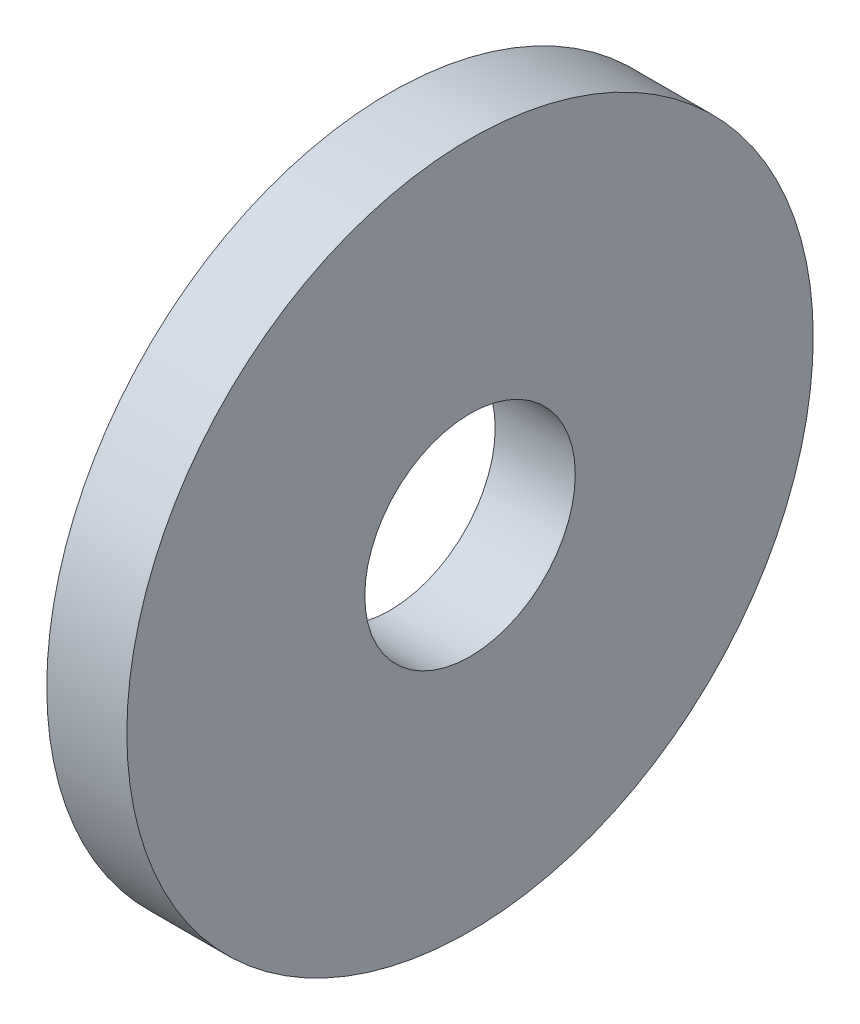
SolidWorks part; units mm, degrees
ref_plane "Plane1" through (0, 0, 0) normal (0, 0, 1) x (1, 0, 0)
ref_plane "Plane2" through (0, 0, 0) normal (0, 1, 0) x (1, 0, 0)
ref_plane "Plane3" through (0, 0, 0) normal (1, 0, 0) x (0, 0, -1)
revolve "Base-Revolve" add sketch "Sketch1" angle 360 about L0
sketch "Sketch1" plane through (0, 0, 0) normal (0, 0, 1) x (1, 0, 0)
  line L0 (-34.925, 0) -> (9.525, 0) construction
  line L1 (0, 1.84) -> (0, 6)
  line L2 (0, 6) -> (-1.4, 6)
  line L3 (-1.4, 6) -> (-1.4, 1.84)
  line L4 (-1.4, 1.84) -> (0, 1.84)
  dimension "Thickness" = 1.4
  dimension "Inside_dia" = 3.68
  dimension "Outside_dia" = 12
